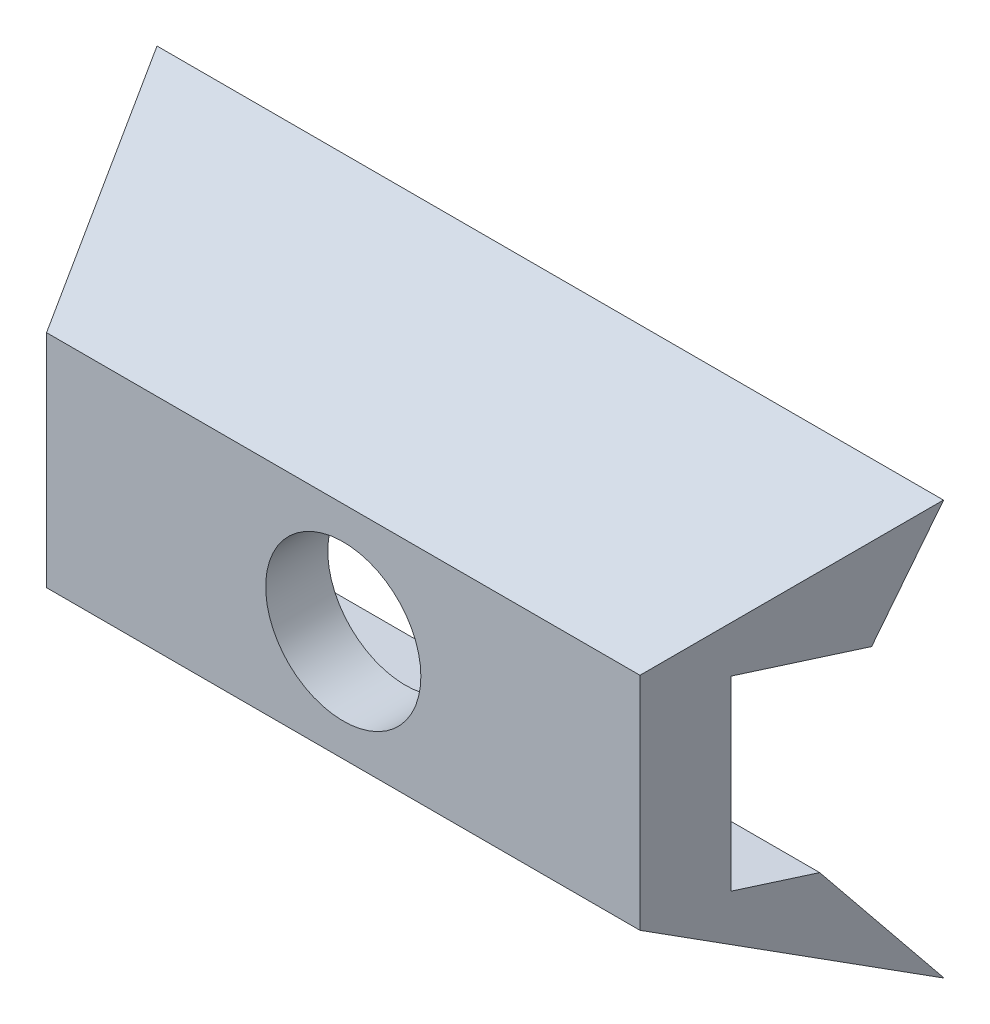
SolidWorks part; units mm, degrees
ref_plane "前视基准面" through (0, 0, 0) normal (0, 0, 1) x (1, 0, 0)
ref_plane "上视基准面" through (0, 0, 0) normal (0, 1, 0) x (1, 0, 0)
ref_plane "右视基准面" through (0, 0, 0) normal (1, 0, 0) x (0, 0, -1)
sketch "草图1" plane through (0, 0, 0) normal (0, 0, 1) x (1, 0, 0)
  line L0 (-100.3592, 0) -> (98.7534, 0) construction
  line L1 (0, -59.8141) -> (0, 60.2155) construction
  line L3 (-38, 20) -> (38, 20)
  line L4 (-38, 20) -> (-38, -20)
  line L5 (-38, -20) -> (38, -20)
  line L6 (38, 20) -> (38, -20)
  dimension "D1" = 76
  dimension "D2" = 40
extrude "拉伸1" add sketch "草图1" along normal blind 20 draft 25
sketch "草图2" plane through (0, 0, 0) normal (1, 0, 0) x (0, 0, -1)
  line L0 (-14, 9) -> (-14, -9)
  line L1 (-14, -9) -> (-8.1581, -9)
  line L2 (-8.1581, -9) -> (19.2137, -45.7588)
  line L3 (-14, 9) -> (-4.7327, 9)
  line L4 (-4.7327, 9) -> (19.2137, 64.5294)
  line L5 (19.2137, 64.5294) -> (19.2137, -45.7588)
  line L7 (0, -20) -> (0, 20) construction
  dimension "D1" = 18
  dimension "D2" = 120
  dimension "D3" = 14
  dimension "D4" = 11
extrude "切除-拉伸1" cut sketch "草图2" against normal through all and the other way through all
sketch "草图3" plane through (0, 0, 20) normal (0, 0, 1) x (1, 0, 0)
  circle A0 centre (0, 0) radius 7.5
extrude "切除-拉伸2" cut sketch "草图3" against normal through all
